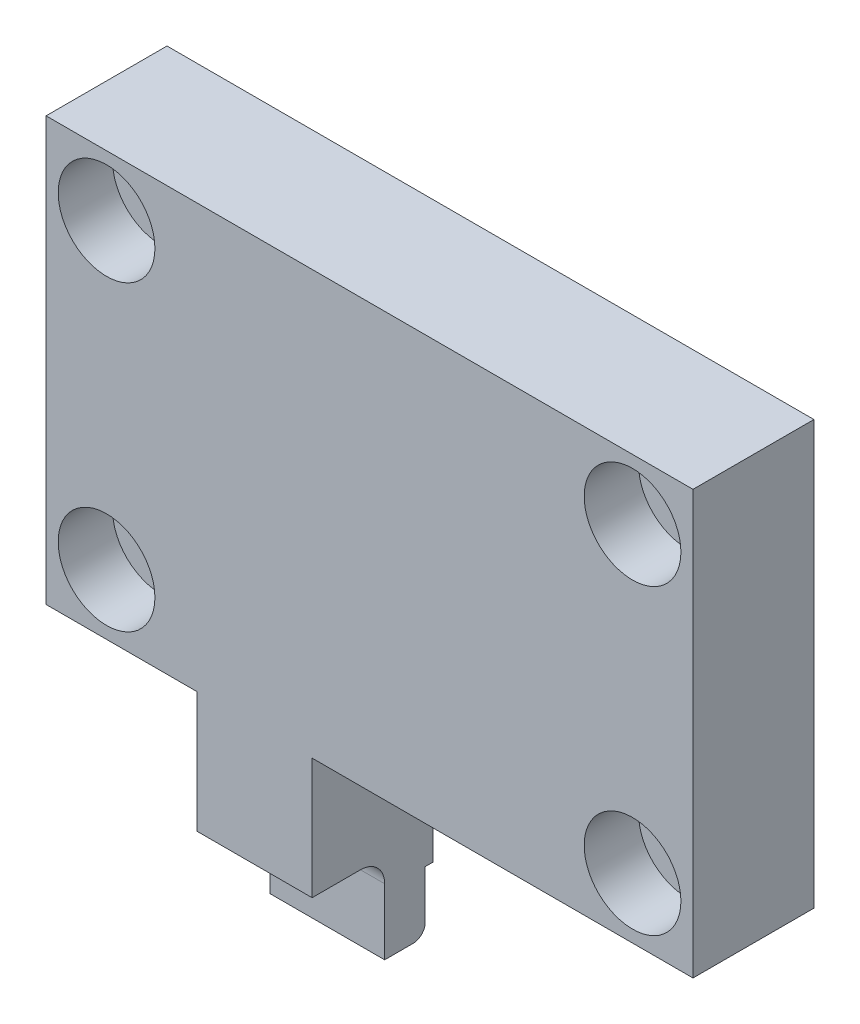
SolidWorks part; units mm, degrees
ref_plane "前视基准面" through (0, 0, 0) normal (0, 0, 1) x (1, 0, 0)
ref_plane "上视基准面" through (0, 0, 0) normal (0, 1, 0) x (1, 0, 0)
ref_plane "右视基准面" through (0, 0, 0) normal (1, 0, 0) x (0, 0, -1)
sketch "草图1" plane through (0, 0, 0) normal (0, 0, 1) x (1, 0, 0)
  line L0 (0, 17.45) -> (0, 52.45)
  line L1 (53.5, 17.45) -> (53.5, 52.45)
  line L2 (0, 52.45) -> (53.5, 52.45)
  line L3 (0, 17.45) -> (12.5, 17.45)
  line L4 (12.5, 0) -> (22, 0)
  line L5 (12.5, 0) -> (12.5, 17.45)
  line L6 (22, 0) -> (22, 17.45)
  line L7 (22, 17.45) -> (53.5, 17.45)
  circle A0 centre (5, 47.45) radius 2.25
  circle A1 centre (48.5, 47.45) radius 2.25
  circle A2 centre (48.5, 22.45) radius 2.25
  circle A3 centre (5, 22.45) radius 2.25
extrude "凸台-拉伸1" add sketch "草图1" along normal blind 10
sketch "草图2" plane through (0, 0, 10) normal (0, 0, 1) x (1, 0, 0)
  circle A0 centre (5, 47.45) radius 4
  circle A1 centre (48.5, 47.45) radius 4
  circle A2 centre (48.5, 22.45) radius 4
  circle A3 centre (5, 22.45) radius 4
extrude "切除-拉伸1" cut sketch "草图2" against normal blind 4.5
sketch "草图3" plane through (53.5, 0, 0) normal (1, 0, 0) x (0, 0, -1)
  line L0 (0, 5) -> (0, 52.45)
  line L1 (-10, 7.45) -> (-10, 52.45)
  line L2 (-10, 52.45) -> (0, 52.45)
  line L3 (-4, 0) -> (-4, 5.45)
  line L4 (-4, 0) -> (-1.65, 0)
  line L5 (-10, 7.45) -> (-6, 7.45)
  line L6 (-0.65, 1) -> (-0.65, 5)
  line L7 (-0.65, 5) -> (0, 5)
  arc A0 (-4, 5.45) -> (-6, 7.45) centre (-6, 5.45) ccw
  arc A1 (-1.65, 0) -> (-0.65, 1) centre (-1.65, 1) ccw
extrude "切除-拉伸2" cut sketch "草图3" against normal through all flip side to cut
